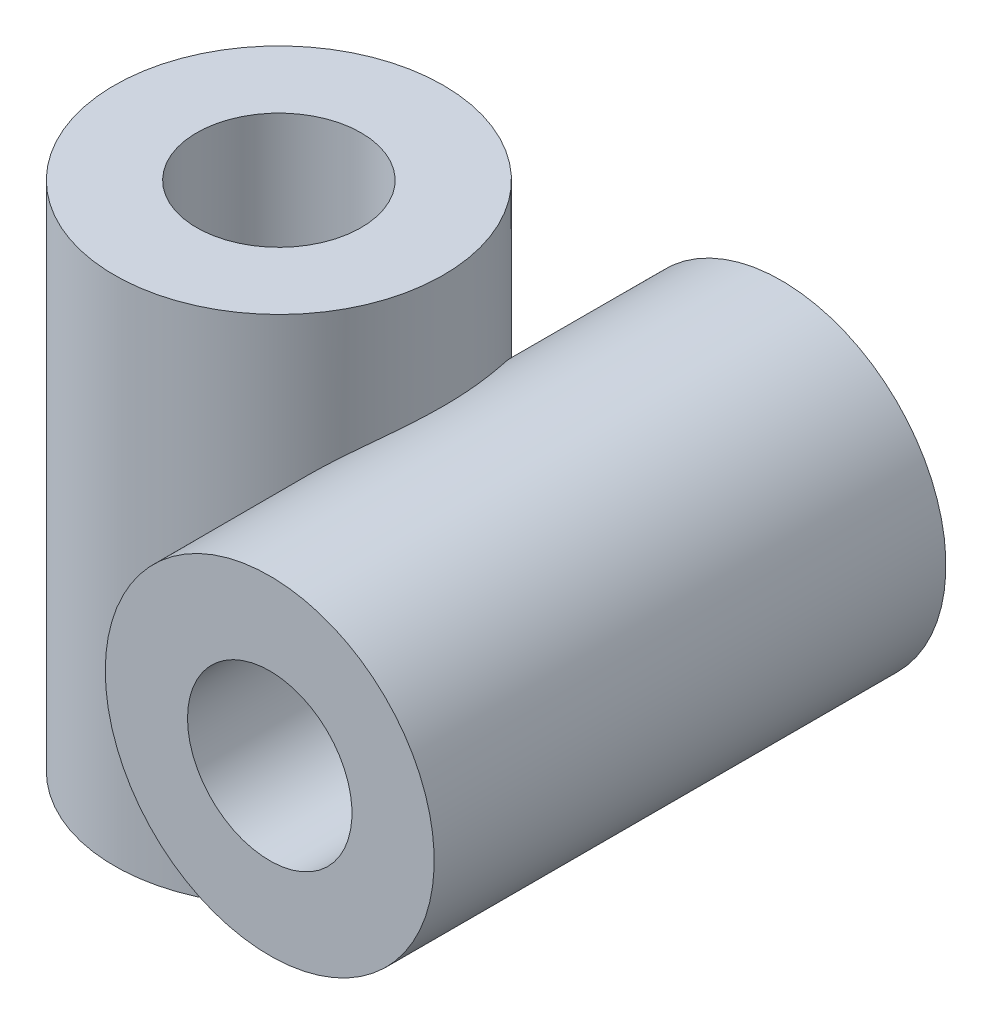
SolidWorks part; units mm, degrees
ref_plane "Front Plane" through (0, 0, 0) normal (0, 0, 1) x (1, 0, 0)
ref_plane "Top Plane" through (0, 0, 0) normal (0, 1, 0) x (1, 0, 0)
ref_plane "Right Plane" through (0, 0, 0) normal (1, 0, 0) x (0, 0, -1)
ref_plane "Plane1" through (0, 0, 0) normal (0, -1, 0) x (1, 0, 0)
sketch "Sketch1" plane through (0, 0, 0) normal (0, -1, 0) x (1, 0, 0)
  line L0 (22.5, 14) -> (13.5, 14)
  line L1 (13.5, 14) -> (13.5, -14)
  line L2 (13.5, -14) -> (22.5, -14)
  line L3 (22.5, -14) -> (22.5, 14)
  line L4 (13.5, 14.003) -> (13.5, -14.003) construction
revolve "Revolve1" add sketch "Sketch1" angle 360 about L4
sketch "Sketch2" plane through (0, 0, 0) normal (1, 0, 0) x (0, 0, -1)
  line L0 (0, -14) -> (9, -14)
  line L1 (9, -14) -> (9, 14)
  line L2 (9, 14) -> (0, 14)
  line L3 (0, 14) -> (0, -14)
  line L4 (0, 14) -> (0, -14) construction
revolve "Revolve2" add sketch "Sketch2" angle 360 about L4
hole_wizard "Ø9.0 (9) Diameter Hole1" positions "Sketch4" profile "Sketch3" hole size "Ø9.0" standard "ANSI Metric"
sketch "Sketch4" plane through (0, -14, 0) normal (0, -1, 0) x (-1, 0, 0)
  point P0 (0, 0)
sketch "Sketch3" plane through (0, -14, 0) normal (1, 0, 0) x (0, 0, -1)
  line L0 (0, 0) -> (0, 28)
  line L1 (0, 28) -> (4.5, 28)
  line L2 (4.5, 28) -> (4.5, 0)
  line L5 (4.5, 0) -> (0, 0)
  line L11 (0, -6.35) -> (0, 107.95) construction
  dimension "Thru Hole Dia." = 9
  dimension "Thru Hole Depth" = 28
hole_wizard "Ø9.0 (9) Diameter Hole2" positions "Sketch6" profile "Sketch5" hole size "Ø9.0" standard "ANSI Metric"
sketch "Sketch6" plane through (0, 0, -14) normal (0, 0, -1) x (-1, 0, 0)
  point P0 (-13.5, 0)
sketch "Sketch5" plane through (13.5, 0, -14) normal (1, 0, 0) x (0, 1, 0)
  line L0 (0, 0) -> (0, 28)
  line L1 (0, 28) -> (4.5, 28)
  line L2 (4.5, 28) -> (4.5, 0)
  line L5 (4.5, 0) -> (0, 0)
  line L11 (0, -6.35) -> (0, 107.95) construction
  dimension "Thru Hole Dia." = 9
  dimension "Thru Hole Depth" = 28
